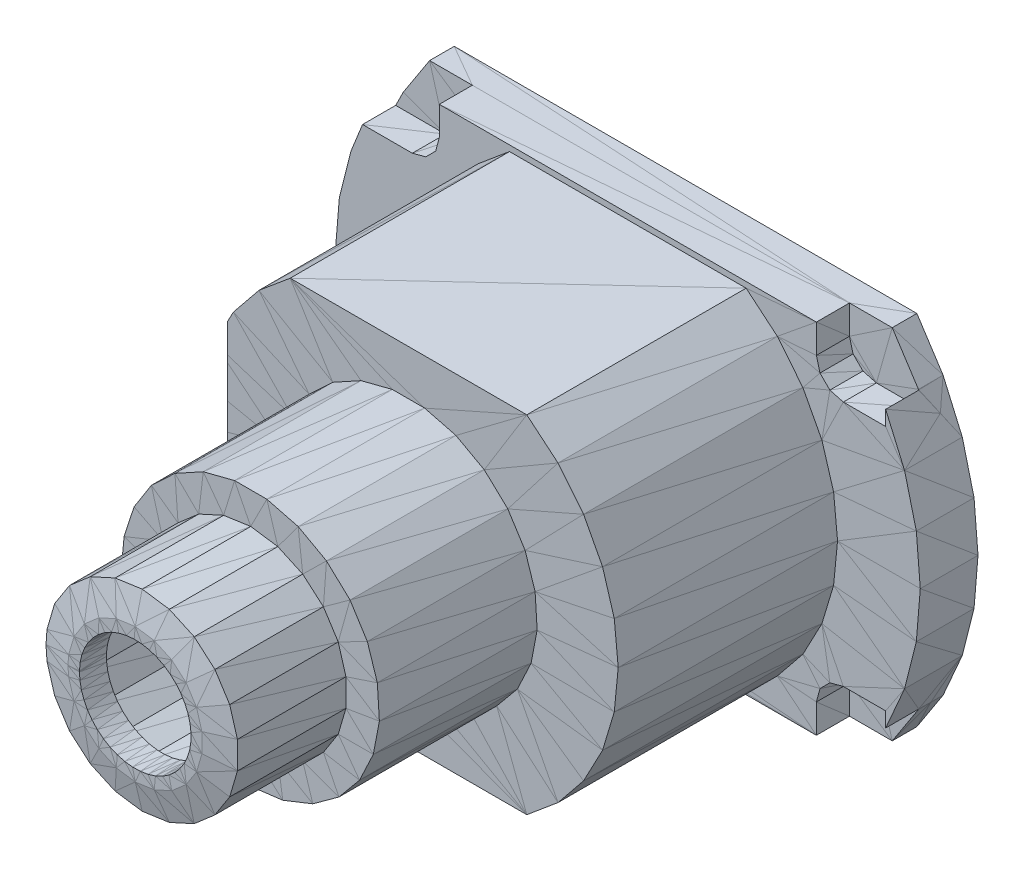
SolidWorks part; units mm, degrees
ref_plane "Front Plane" through (0, 0, 0) normal (0, 0, 1) x (1, 0, 0)
ref_plane "Top Plane" through (0, 0, 0) normal (0, 1, 0) x (1, 0, 0)
ref_plane "Right Plane" through (0, 0, 0) normal (1, 0, 0) x (0, 0, -1)
imported_body "Imported1"
sketch "Sketch1" plane through (0, 0, -128) normal (0, 0, 1) x (1, 0, 0)
  line L1 (-58.0573, 51.5302) -> (-47.0174, 51.5302)
  line L2 (-58.0573, 51.5302) -> (-58.0573, -56.7777)
  line L3 (-58.0573, -56.7777) -> (-47.0174, -56.7777)
  line L4 (-47.0174, 51.5302) -> (-47.0174, -56.7777)
extrude "Cut-Extrude1" cut sketch "Sketch1" along normal blind 70
